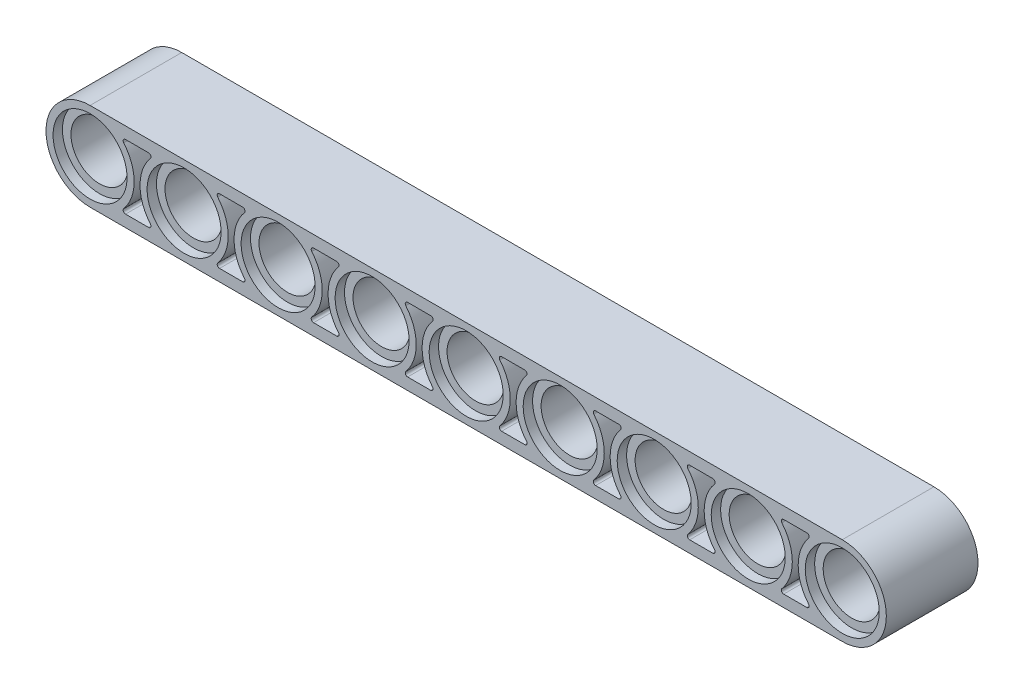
SolidWorks part; units mm, degrees
ref_plane "Front Plane" through (0, 0, 0) normal (0, 0, 1) x (1, 0, 0)
ref_plane "Top Plane" through (0, 0, 0) normal (0, 1, 0) x (1, 0, 0)
ref_plane "Right Plane" through (0, 0, 0) normal (1, 0, 0) x (0, 0, -1)
other "Configuration Table"
sketch "Sketch1" plane through (0, 0, 0) normal (0, 0, 1) x (1, 0, 0)
  line L0 (0, 0) -> (64, 0) construction
  line L1 (0, 3.75) -> (64, 3.75)
  line L2 (0, -3.75) -> (64, -3.75)
  arc A0 (0, 3.75) -> (0, -3.75) centre (0, 0) ccw
  arc A1 (64, -3.75) -> (64, 3.75) centre (64, 0) ccw
  point P3 (32, 0)
  dimension "D2" = 3.75
  dimension "D1" = 64
extrude "Body" add sketch "Sketch1" along normal mid plane 7.8
ref_axis "Hole Axis" through (0, 0, -4.29) along (0, 0, 1)
sketch "Sketch2" plane through (0, 0, 0) normal (0, 1, 0) x (1, 0, 0)
  line L0 (0, -3.9) -> (0, 3.9)
  line L1 (0, 3.9) -> (3.15, 3.9)
  line L2 (64, 3.9) -> (0, 3.9) construction
  line L3 (3.15, 3.9) -> (3.15, 3.1)
  line L4 (3.15, 3.1) -> (2.425, 3.1)
  line L5 (2.425, 3.1) -> (2.425, -3.1)
  line L6 (2.425, -3.1) -> (3.15, -3.1)
  line L7 (3.15, -3.1) -> (3.15, -3.9)
  line L8 (64, -3.9) -> (0, -3.9) construction
  line L9 (3.15, -3.9) -> (0, -3.9)
revolve "Hole" cut sketch "Sketch2" angle 360 about axis through (0, 0, -4.29) along (0, 0, 1)
sketch "Sketch3" plane through (0, 0, 3.9) normal (0, 0, 1) x (1, 0, 0)
  line L0 (3.0166, 2.75) -> (4.9834, 2.75)
  line L1 (3.0166, -2.75) -> (4.9834, -2.75)
  arc A0 (2.8639, -2.4209) -> (2.8639, 2.4209) centre (0, 0) ccw
  arc A1 (5.1361, 2.4209) -> (5.1361, -2.4209) centre (8, 0) ccw
  arc A2 (3.0166, -2.75) -> (2.8639, -2.4209) centre (3.0166, -2.55) cw
  arc A3 (4.9834, -2.75) -> (5.1361, -2.4209) centre (4.9834, -2.55) ccw
  arc A4 (5.1361, 2.4209) -> (4.9834, 2.75) centre (4.9834, 2.55) ccw
  arc A5 (3.0166, 2.75) -> (2.8639, 2.4209) centre (3.0166, 2.55) ccw
  dimension "D1" = 7.5
  dimension "D4" = 7.5
  dimension "D5" = 8
  dimension "D6" = 0.2
  dimension "D2" = 5.5
  dimension "D3" = 2.75
extrude "Cut Out" cut sketch "Sketch3" against normal blind 3.4
mirror "Mirror1" about plane through (0, 0, 0) normal (0, 0, 1) of "Cut Out"
pattern_linear "HOLE Pattern" count 9 spacing 8 along (1, 0, 0) of "Hole"
pattern_linear "CUT OUT Pattern" count 8 spacing 8 along (1, 0, 0) of "Cut Out", "Mirror1"
equation "\"D3@Sketch2\"=\"D1@Sketch2\""
equation "\"D5@Sketch2\"= \"D4@Sketch2\""
